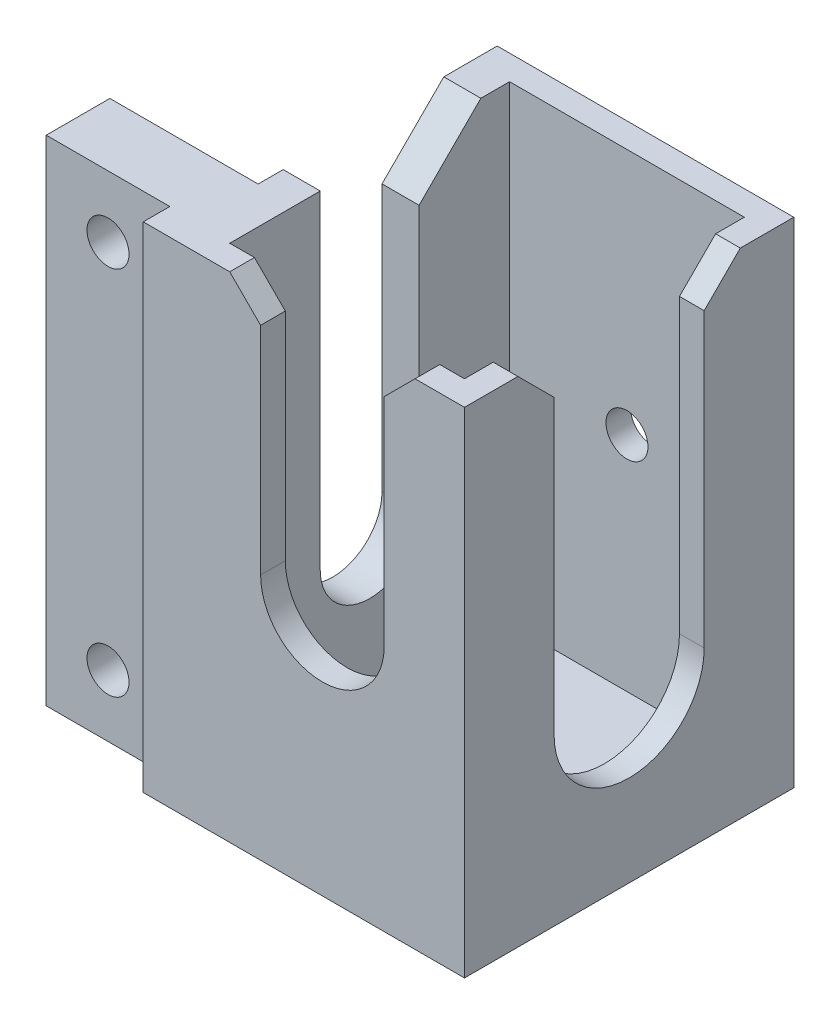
SolidWorks part; units mm, degrees
ref_plane "Front Plane" through (0, 0, 0) normal (0, 0, 1) x (1, 0, 0)
ref_plane "Top Plane" through (0, 0, 0) normal (0, 1, 0) x (1, 0, 0)
ref_plane "Right Plane" through (0, 0, 0) normal (1, 0, 0) x (0, 0, -1)
sketch "Sketch1" plane through (0, 0, 0) normal (0, 1, 0) x (1, 0, 0)
  line L21 (9.5, 11.325) -> (-9.5, 11.325)
  line L22 (-9.5, 11.325) -> (-9.5, -11.325)
  line L23 (-9.5, -11.325) -> (9.5, -11.325)
  line L24 (9.5, -11.325) -> (9.5, 11.325)
  line L25 (-14.5, -13.325) -> (11.5, -13.325)
  line L26 (11.5, -13.325) -> (11.5, 13.325)
  line L27 (11.5, 13.325) -> (-12.5, 13.325)
  line L28 (-12.5, 13.325) -> (-12.5, -6.025)
  line L29 (-12.5, -6.025) -> (-24.5, -6.025)
  line L30 (-24.5, -6.025) -> (-24.5, -11.175)
  line L31 (-24.5, -11.175) -> (-14.5, -11.175)
  line L32 (-14.5, -11.175) -> (-14.5, -13.325)
  line L33 (0, -11.325) -> (0, 11.325) construction
  point P31 (0, 0)
  dimension "D1" = 19
  dimension "D2" = 22.65
  dimension "D3" = 2
  dimension "D4" = 2
  dimension "D5" = 2
  dimension "D6" = 3
  dimension "D7" = 2
  dimension "D8" = 10
  dimension "D9" = 2.15
  dimension "D10" = 5.15
extrude "Boss-Extrude1" add sketch "Sketch1" along normal blind 40
sketch "Sketch2" plane through (0, 0, 0) normal (0, -1, 0) x (1, 0, 0)
  line L5 (-1.73, 2.75) -> (-1.73, -2.75)
  line L6 (-1.73, -2.75) -> (1.73, -2.75)
  line L7 (1.73, -2.75) -> (1.73, 2.75)
  line L8 (-14.5, 13.325) -> (-14.5, 11.175)
  line L9 (-14.5, 11.175) -> (-24.5, 11.175)
  line L10 (-24.5, 11.175) -> (-24.5, 6.025)
  line L11 (-24.5, 6.025) -> (-12.5, 6.025)
  line L12 (-12.5, 6.025) -> (-12.5, -13.325)
  line L13 (-12.5, -13.325) -> (11.5, -13.325)
  line L14 (11.5, -13.325) -> (11.5, 13.325)
  line L15 (11.5, 13.325) -> (-14.5, 13.325)
  line L16 (-14.5, 13.325) -> (-14.5, 11.175)
  line L17 (-14.5, 11.175) -> (-24.5, 11.175)
  line L18 (-24.5, 11.175) -> (-24.5, 6.025)
  line L19 (-24.5, 6.025) -> (-12.5, 6.025)
  line L20 (-12.5, 6.025) -> (-12.5, -13.325)
  line L21 (-12.5, -13.325) -> (11.5, -13.325)
  line L22 (11.5, -13.325) -> (11.5, 13.325)
  line L23 (11.5, 13.325) -> (-14.5, 13.325)
  line L24 (1.73, 2.75) -> (-1.73, 2.75)
  line L25 (0, -2.75) -> (0, 2.75) construction
  point P22 (0, 0)
  dimension "D2" = 3.46
  dimension "D3" = 5.5
  dimension "D1" = 0
extrude "Boss-Extrude2" add sketch "Sketch2" against normal blind 2
sketch "Sketch3" plane through (-12.5, 0, 0) normal (-1, 0, 0) x (0, 0, 1)
  line L0 (0, 46.446) -> (0, 13.43) construction
  line L1 (4, 46.446) -> (4, 13.43)
  line L2 (-4, 46.446) -> (-4, 13.43)
  line L3 (-13.325, 40) -> (6.025, 40) construction
  arc A0 (4, 46.446) -> (-4, 46.446) centre (0, 46.446) ccw
  arc A1 (-4, 13.43) -> (4, 13.43) centre (0, 13.43) ccw
  point P3 (0, 29.938)
  dimension "D1" = 8
  dimension "D2" = 26.57
extrude "Cut-Extrude1" cut sketch "Sketch3" against normal blind 3
sketch "Sketch4" plane through (9.5, 0, 0) normal (-1, 0, 0) x (0, 0, 1)
  line L0 (0, 43.3627) -> (0, 13.43) construction
  line L1 (6.075, 43.3627) -> (6.075, 13.43)
  line L2 (-6.075, 43.3627) -> (-6.075, 13.43)
  arc A0 (6.075, 43.3627) -> (-6.075, 43.3627) centre (0, 43.3627) ccw
  arc A1 (-6.075, 13.43) -> (6.075, 13.43) centre (0, 13.43) ccw
  point P3 (0, 28.3963)
  dimension "D1" = 12.15
extrude "Cut-Extrude2" cut sketch "Sketch4" against normal blind 2
sketch "Sketch5" plane through (0, 0, 13.325) normal (0, 0, 1) x (1, 0, 0)
  line L1 (-14.5, 40) -> (11.5, 40) construction
  line L2 (0, 47.9306) -> (0, 20) construction
  line L3 (5, 47.9306) -> (5, 20)
  line L4 (-5, 47.9306) -> (-5, 20)
  arc A0 (5, 47.9306) -> (-5, 47.9306) centre (0, 47.9306) ccw
  arc A1 (-5, 20) -> (5, 20) centre (0, 20) ccw
  point P5 (0, 33.9653)
  dimension "D1" = 10
  dimension "D2" = 20
extrude "Cut-Extrude3" cut sketch "Sketch5" against normal blind 2
sketch "Sketch7" plane through (-24.5, 0, 0) normal (-1, 0, 0) x (0, 0, 1)
  line L0 (6.025, 30) -> (10.175, 25.85)
  line L1 (6.025, 40) -> (6.025, 0) construction
  line L2 (10.175, 25.85) -> (10.175, 14.15)
  line L3 (10.175, 14.15) -> (6.025, 10)
  line L4 (6.025, 40) -> (11.175, 40) construction
  line L5 (6.025, 0) -> (11.175, 0) construction
  line L6 (11.175, 40) -> (11.175, 0) construction
  line L7 (6.025, 10) -> (6.025, 30)
  dimension "D1" = 45
  dimension "D2" = 45
  dimension "D3" = 10
  dimension "D4" = 10
  dimension "D5" = 1
extrude "Cut-Extrude4" cut sketch "Sketch7" against normal up to surface (12 mm away)
sketch "Sketch8" plane through (0, 0, 6.025) normal (0, 0, -1) x (-1, 0, 0)
  line L0 (24.5, 10) -> (14.5, 10) construction
  line L1 (12.5, 10) -> (24.5, 10) construction
  line L2 (14.5, 10) -> (24.5, 0) construction
  line L3 (12.5, 10) -> (12.5, 0) construction
  line L4 (24.5, 20) -> (33.6538, 20) construction
  line L5 (24.5, 14.15) -> (24.5, 25.85) construction
  circle A0 centre (19.5, 5) radius 2.1465
  circle A1 centre (19.5, 35) radius 2.1465
  dimension "D1" = 2
hole_wizard "CBORE for M3 Pan Head Machine Screw1" positions "Sketch9" profile "Sketch10" counterbore size "M3" standard "ANSI Metric"
sketch "Sketch9" plane through (0, 0, 6.025) normal (0, 0, -1) x (-1, 0, 0)
  point P0 (19.5, 35)
  point P3 (19.5, 5)
sketch "Sketch10" plane through (-19.5, 35, 6.025) normal (1, 0, 0) x (0, 1, 0)
  line L0 (0, 0) -> (0, 16)
  line L1 (0, 16) -> (1.7, 14.9785)
  line L2 (1.7, 14.9785) -> (1.7, 2.4)
  line L3 (1.7, 2.4) -> (3.5, 2.4)
  line L4 (3.5, 2.4) -> (3.5, 0)
  line L5 (3.5, 0) -> (0, 0)
  line L10 (0, 16) -> (-1.7, 14.9785) construction
  line L11 (0, -6.35) -> (0, 107.95) construction
  dimension "Hole Dia." = 3.4
  dimension "Hole Depth" = 16
  dimension "C'Bore Dia." = 7
  dimension "C'Bore Depth" = 2.4
  dimension "Drill Angle" = 118
sketch "Sketch11" plane through (0, 0, -13.325) normal (0, 0, -1) x (-1, 0, 0)
  line L0 (0, 0) -> (0, 40) construction
  line L1 (-11.5, 40) -> (12.5, 40) construction
  circle A0 centre (0, 20) radius 1.7
  circle A1 centre (19.5, 35) radius 1.7 construction
extrude "Cut-Extrude5" cut sketch "Sketch11" against normal up to surface (2 mm away)
chamfer "Chamfer2" distance 5 angle 45 1 edges at (-11, 40, -4)
sketch "Sketch12" plane through (11.5, 0, 0) normal (1, 0, 0) x (0, 0, -1)
  line L0 (4, 35) -> (9, 40)
  line L1 (9, 40) -> (4, 40)
  line L2 (4, 40) -> (4, 35)
  line L4 (0, 0) -> (0, 46.0624) construction
  line L5 (-4, 40) -> (-4, 35)
  line L6 (-9, 40) -> (-4, 40)
  line L7 (-4, 35) -> (-9, 40)
extrude "Cut-Extrude6" cut sketch "Sketch12" against normal up to surface (2 mm away)
chamfer "Chamfer3" distance 2.5 angle 45 2 edges at (-5, 40, 12.325) (5, 40, 12.325)
